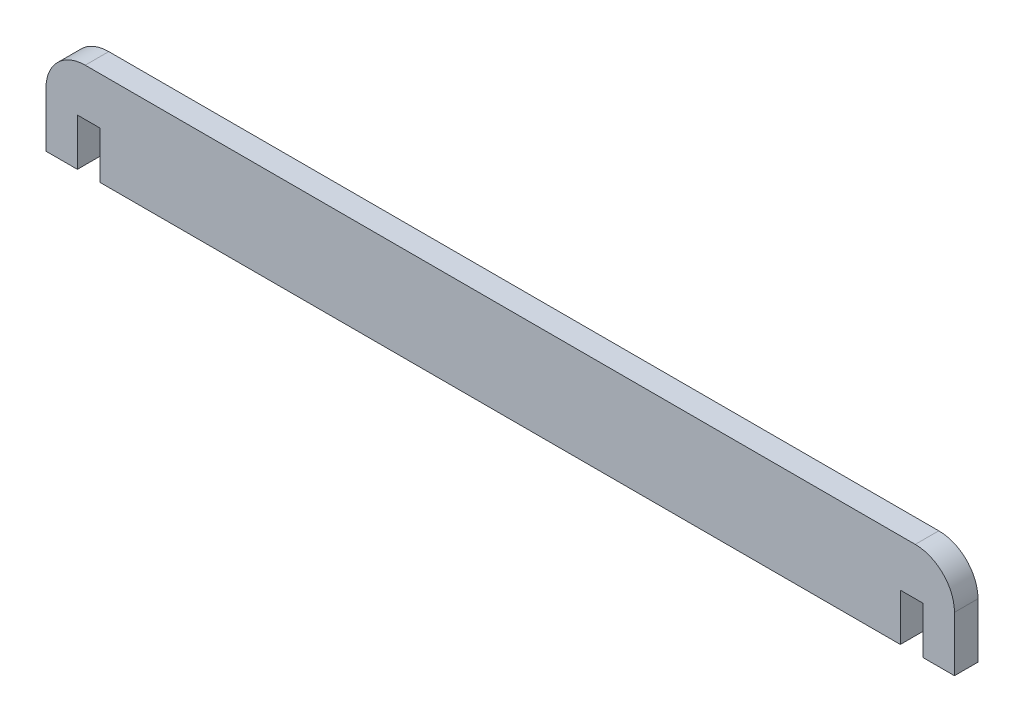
SolidWorks part; units mm, degrees
ref_plane "Plan de face" through (0, 0, 0) normal (0, 0, 1) x (1, 0, 0)
ref_plane "Plan de dessus" through (0, 0, 0) normal (0, 1, 0) x (1, 0, 0)
ref_plane "Plan de droite" through (0, 0, 0) normal (1, 0, 0) x (0, 0, -1)
sketch "Esquisse1" plane through (0, 0, 0) normal (0, 0, 1) x (1, 0, 0)
  line L0 (0, 0) -> (102, 0)
  line L1 (102, 0) -> (102, 6)
  line L2 (102, 6) -> (104.9, 6)
  line L3 (104.9, 6) -> (104.9, 0)
  line L4 (104.9, 0) -> (108.9, 0)
  line L5 (108.9, 0) -> (108.9, 12)
  line L6 (0, 0) -> (0, 6)
  line L7 (0, 6) -> (-2.9, 6)
  line L8 (-2.9, 6) -> (-2.9, 0)
  line L9 (-2.9, 0) -> (-6.9, 0)
  line L10 (-6.9, 0) -> (-6.9, 12)
  line L11 (-6.9, 12) -> (108.9, 12)
  line L12 (-2.9, 6) -> (-2.9, 12) construction
extrude "Boss.-Extru.1" add sketch "Esquisse1" along normal blind 3
fillet "Congé1" radius 5 2 edges at (108.9, 12, 1.5) (-6.9, 12, 1.5)
